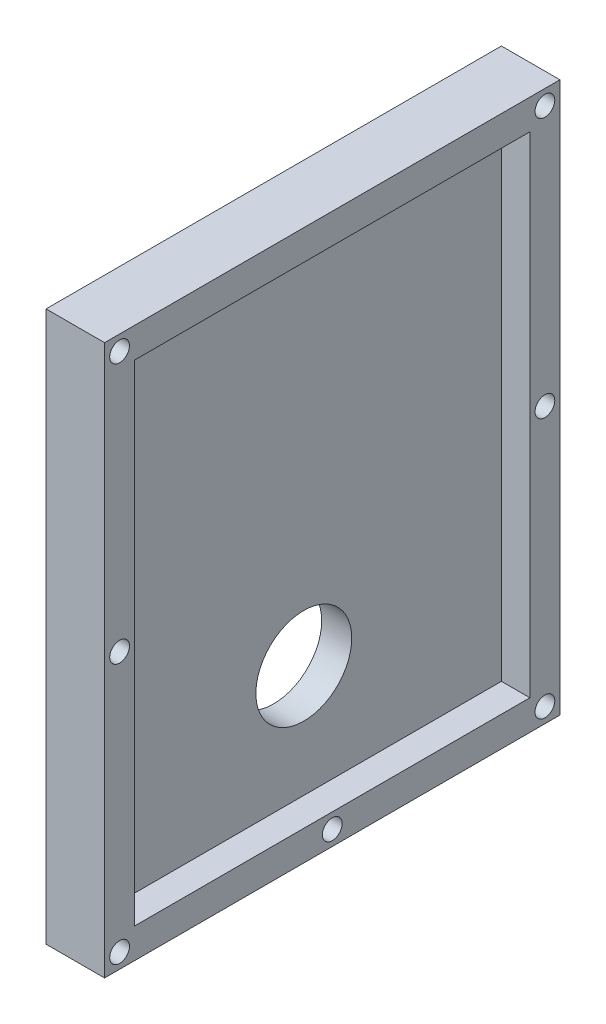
SolidWorks part; units mm, degrees
ref_plane "Front Plane" through (0, 0, 0) normal (1, 0, 0) x (0, 1, 0)
ref_plane "Top Plane" through (0, 0, 0) normal (0, 0, 1) x (0, 1, 0)
ref_plane "Right Plane" through (0, 0, 0) normal (0, 1, 0) x (-1, 0, 0)
sketch "Sketch2" plane through (0, 0, 0) normal (1, 0, 0) x (0, 1, 0)
  line L1 (0, 0) -> (39.37, 0)
  line L2 (0, 0) -> (0, 31.75)
  line L3 (0, 31.75) -> (39.37, 31.75)
  line L4 (39.37, 0) -> (39.37, 31.75)
  dimension "D1" = 39.37
  dimension "D2" = 31.75
extrude "Boss-Extrude1" add sketch "Sketch2" along normal blind 2.286
shell "Shell1" thickness 2.413
sketch "Sketch4" plane through (0, 0, 0) normal (1, 0, 0) x (0, 1, 0)
  line L0 (19.685, 31.75) -> (19.685, 0) construction
  line L1 (39.37, 31.75) -> (0, 31.75) construction
  line L2 (0, 0) -> (39.37, 0) construction
  line L3 (19.685, 15.875) -> (39.37, 15.875) construction
  line L4 (39.37, 0) -> (39.37, 31.75) construction
  line L5 (39.37, 15.875) -> (0, 15.875) construction
  circle A0 centre (9.017, 15.875) radius 3.8509
  dimension "D2" = 7.7018
  dimension "D1" = 10.668
extrude "Cut-Extrude1" cut sketch "Sketch4" against normal through all
sketch "Sketch5" plane through (2.286, 0, 0) normal (1, 0, 0) x (0, 0, -1)
  line L0 (-15.875, 39.37) -> (-15.875, 41.783) construction
  line L3 (-34.163, -1.2065) -> (2.413, -1.2065) construction
  line L4 (-34.163, 41.783) -> (-34.163, -2.413) construction
  line L5 (2.413, -2.413) -> (2.413, 41.783) construction
  line L8 (2.413, 19.685) -> (-34.163, 19.685) construction
  line L9 (0, 39.37) -> (-31.75, 39.37) construction
  line L10 (2.413, 41.783) -> (-34.163, 41.783) construction
  line L11 (2.413, 40.5765) -> (-34.163, 40.5765) construction
  line L12 (2.413, 19.685) -> (0, 19.685) construction
  line L13 (0, 1.2573) -> (0, -1.2573) construction
  line L14 (1.2065, -2.413) -> (1.2065, 41.783) construction
  line L15 (-34.163, -2.413) -> (2.413, -2.413) construction
  line L16 (-31.75, 19.685) -> (-34.163, 19.685) construction
  line L17 (-31.75, 39.37) -> (-31.75, 0) construction
  line L18 (-32.9565, -2.413) -> (-32.9565, 41.783) construction
  circle A0 centre (-32.9565, -1.2065) radius 0.7937
  circle A1 centre (-32.9565, 19.685) radius 0.7937
  circle A2 centre (-32.9565, 40.5765) radius 0.7937
  circle A4 centre (1.2065, 40.5765) radius 0.7937
  circle A5 centre (1.2065, 19.685) radius 0.7937
  circle A6 centre (1.2065, -1.2065) radius 0.7938
  circle A7 centre (-15.875, -1.2065) radius 0.7937
  dimension "D5" = 1.5875
  dimension "D1" = 20.8915
  dimension "D2" = 35.3695
  dimension "D3" = 42.9895
  dimension "D4" = 34.163
extrude "Cut-Extrude2" cut sketch "Sketch5" against normal through all
